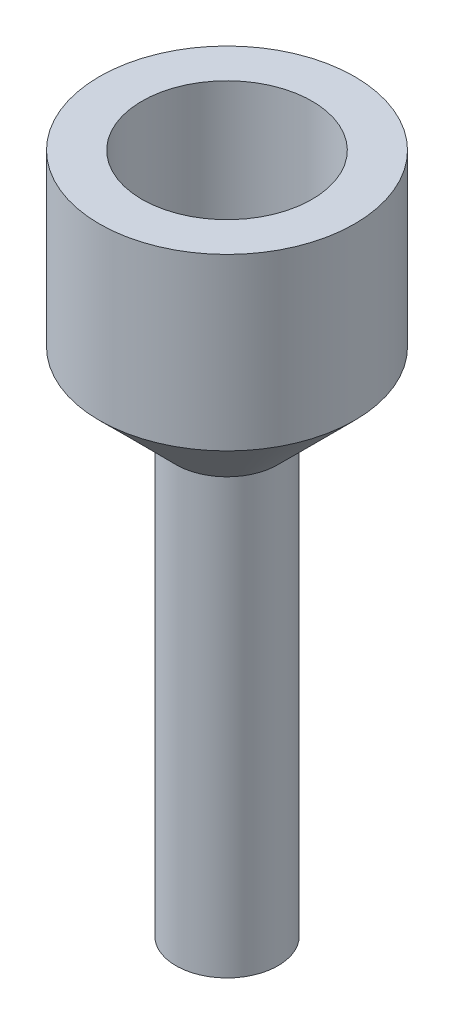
SolidWorks part; units mm, degrees
ref_plane "Front" through (0, 0, 0) normal (0, 0, 1) x (1, 0, 0)
ref_plane "Top" through (0, 0, 0) normal (0, 1, 0) x (1, 0, 0)
ref_plane "Right" through (0, 0, 0) normal (1, 0, 0) x (0, 0, -1)
sketch "Sketch1" plane through (0, 0, 0) normal (0, 0, 1) x (1, 0, 0)
  line L0 (0, 0) -> (6, 0)
  line L1 (6, 0) -> (6, 51)
  line L2 (6, 51) -> (15, 60)
  line L3 (15, 60) -> (15, 80)
  line L4 (15, 80) -> (0, 80)
  line L5 (0, 80) -> (0, 0)
  dimension "D1" = 6
  dimension "D2" = 51
  dimension "D3" = 29
  dimension "D4" = 15
  dimension "D5" = 20
revolve "Revolve1" add sketch "Sketch1" angle 360 about L5
hole_wizard "M20.0 (20.000000) Diameter Hole1" positions "3DSketch1" profile "Sketch2" hole size "M20.0" standard "ISO"
sketch3d "3DSketch1"
  line L0 (0, 60, 0) -> (0, 80, 0) construction
  point P0 (0, 80, 0)
sketch "Sketch2" plane through (0, 80, 0) normal (1, 0, 0) x (0, 0, 1)
  line L0 (0, 0) -> (0, 21.0086)
  line L1 (0, 21.0086) -> (10, 15)
  line L2 (10, 15) -> (10, 0)
  line L5 (10, 0) -> (0, 0)
  line L10 (0, 21.0086) -> (-10, 15) construction
  line L11 (0, -6.35) -> (0, 107.95) construction
  dimension "Hole Dia." = 20
  dimension "Hole Depth" = 15
  dimension "Drill Angle" = 118
hole_wizard "M6 Tapped Hole1" positions "3DSketch3" profile "Sketch4" tap size "M6" standard "ISO"
sketch3d "3DSketch3"
  point P0 (0, 0, 0)
  point P5 (0, 0, 0)
sketch "Sketch4" plane through (0, 0, 0) normal (1, 0, 0) x (0, 0, -1)
  line L0 (0, 0) -> (0, 16.5022)
  line L1 (0, 16.5022) -> (2.5, 15)
  line L2 (2.5, 15) -> (2.5, 0)
  line L5 (2.5, 0) -> (0, 0)
  line L10 (0, 16.5022) -> (-2.5, 15) construction
  line L11 (0, -6.35) -> (0, 107.95) construction
  dimension "Tap Drill Dia." = 5
  dimension "Tap Drill Depth" = 15
  dimension "Drill Angle" = 118
